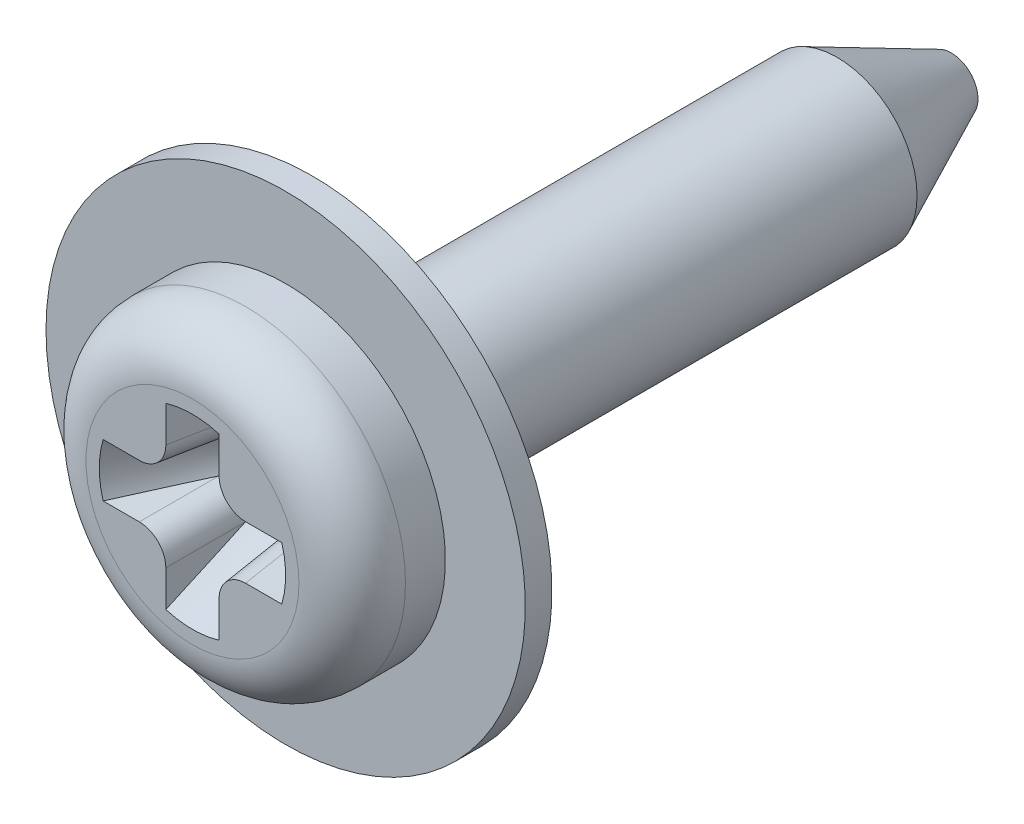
SolidWorks part; units mm, degrees
ref_plane "Plan1" through (0, 0, 0) normal (0, 0, 1) x (1, 0, 0)
ref_plane "Plan2" through (0, 0, 0) normal (0, 1, 0) x (1, 0, 0)
ref_plane "Plan3" through (0, 0, 0) normal (1, 0, 0) x (0, 0, -1)
sketch "Esquisse1" plane through (0, 0, 0) normal (0, 0, 1) x (1, 0, 0)
  circle A0 centre (0, 0) radius 1.5
  dimension "D1" = 3
extrude "Base-Extrusion" add sketch "Esquisse1" along normal blind 12
sketch "Esquisse2" plane through (0, 0, 12) normal (0, 0, 1) x (1, 0, 0)
  circle A2 centre (0, 0) radius 3
  circle A3 centre (0, 0) radius 3
  dimension "D1" = 1.5
extrude "Boss.-Extru.1" add sketch "Esquisse2" along normal blind 2.25
chamfer "Chanfrein1" distance 1 angle 65
sketch "Esquisse11" plane through (0, 0, 12) normal (0, 0, -1) x (-1, 0, 0)
  circle A0 centre (0, 0) radius 4.5
  dimension "D1" = 9
extrude "Boss.-Extru.7" add sketch "Esquisse11" against normal blind 0.5
sketch "Esquisse8" plane through (0, 0, 14.25) normal (0, 0, 1) x (1, 0, 0)
  circle A0 centre (0, 0) radius 1.75
  dimension "D1" = 3.5
extrude "Enlèv. mat.-Extru.4" cut sketch "Esquisse8" against normal blind 1.5 draft 30
sketch "Esquisse9" plane through (0, 0, 12.75) normal (0, 0, 1) x (1, 0, 0)
  circle A1 centre (0, 0) radius 0.884 construction
  circle A2 centre (0, 0) radius 0.884
extrude "Enlèv. mat.-Extru.5" cut sketch "Esquisse9" against normal blind 0.85 draft 45
sketch "Esquisse10" plane through (0, 0, 14.25) normal (0, 0, 1) x (1, 0, 0)
  line L0 (2.9698, 0) -> (-2.8626, 0) construction
  line L1 (0, 2.7331) -> (0, -2.6438) construction
  line L2 (0.5, 1.75) -> (0.5, 0.5)
  line L3 (0.5, 0.5) -> (1.75, 0.5)
  line L4 (-0.5, 1.75) -> (0.5, 1.75)
  line L5 (1.75, 0.5) -> (1.75, -0.5)
  line L6 (0.5, -1.75) -> (-0.5, -1.75)
  line L7 (0.5, -0.5) -> (1.75, -0.5)
  line L8 (0.5, -1.75) -> (0.5, -0.5)
  line L9 (-0.5, -1.75) -> (-0.5, -0.5)
  line L10 (-0.5, -0.5) -> (-1.75, -0.5)
  line L11 (-1.75, 0.5) -> (-1.75, -0.5)
  line L12 (-0.5, 0.5) -> (-1.75, 0.5)
  line L13 (-0.5, 1.75) -> (-0.5, 0.5)
  circle A0 centre (0, 0) radius 2.5
  point P13 (2.0588, 0)
  point P17 (0, -1.75)
  point P18 (0, 1.75)
  point P20 (-2.0588, 0)
  point P23 (0.5, 0.5)
  point P26 (-0.5, 0.5)
  point P29 (-0.5, -0.5)
  point P32 (0.5, -0.5)
  point P34 (0, 1.75)
  dimension "D1" = 1
  dimension "D2" = 1.75
  dimension "D3" = 5
extrude "Boss.-Extru.6" add sketch "Esquisse10" against normal blind 1.75 draft 5
fillet "Congé5" radius 0.5
fillet "Congé4" radius 1
